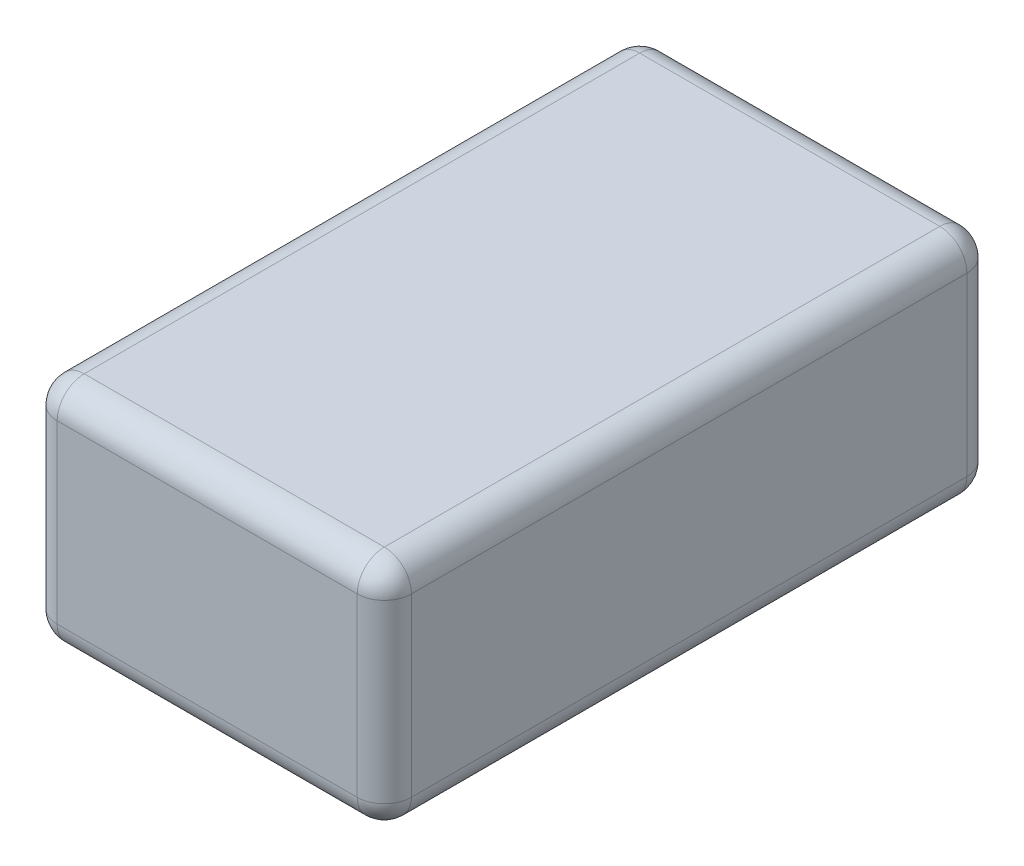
SolidWorks part; units mm, degrees
ref_plane "Front Plane" through (0, 0, 0) normal (0, 0, 1) x (1, 0, 0)
ref_plane "Top Plane" through (0, 0, 0) normal (0, 1, 0) x (1, 0, 0)
ref_plane "Right Plane" through (0, 0, 0) normal (1, 0, 0) x (0, 0, -1)
sketch "Sketch2" plane through (0, 0, 0) normal (0, 1, 0) x (1, 0, 0)
  line L1 (-13.075, 22.5) -> (13.075, 22.5)
  line L2 (-13.075, 22.5) -> (-13.075, -22.5)
  line L3 (-13.075, -22.5) -> (13.075, -22.5)
  line L4 (13.075, 22.5) -> (13.075, -22.5)
  line L5 (-13.075, 22.5) -> (13.075, -22.5) construction
  line L6 (-13.075, -22.5) -> (13.075, 22.5) construction
  point P0 (0, 0)
  dimension "D1" = 26.15
  dimension "D2" = 45
extrude "Boss-Extrude1" add sketch "Sketch2" along normal blind 17
fillet "Fillet1" radius 2 12 edges at (-13.075, 0, 0) (-13.075, 8.5, -22.5) (0, 0, -22.5) (0, 0, 22.5) (-13.075, 8.5, 22.5) (13.075, 8.5, -22.5) (13.075, 0, 0) (0, 17, -22.5) (-13.075, 17, 0) (0, 17, 22.5) (13.075, 8.5, 22.5) (13.075, 17, 0)
sketch "Sketch3" plane through (0, 0, -22.5) normal (0, 0, 1) x (1, 0, 0)
  line L0 (-11.075, 8.5) -> (11.075, 8.5) construction
  line L1 (-11.075, 15) -> (-11.075, 2) construction
  line L2 (11.075, 2) -> (11.075, 15) construction
  circle A0 centre (-6, 8.5) radius 4
  circle A1 centre (6, 8.5) radius 3
  point P10 (-7.4665, 8.5)
  point P11 (6.2856, 8.5)
  dimension "D1" = 8
  dimension "D2" = 6
  dimension "D3" = 12
  dimension "D4" = 5.075
extrude "Boss-Extrude2" add sketch "Sketch3" against normal blind 2.8
